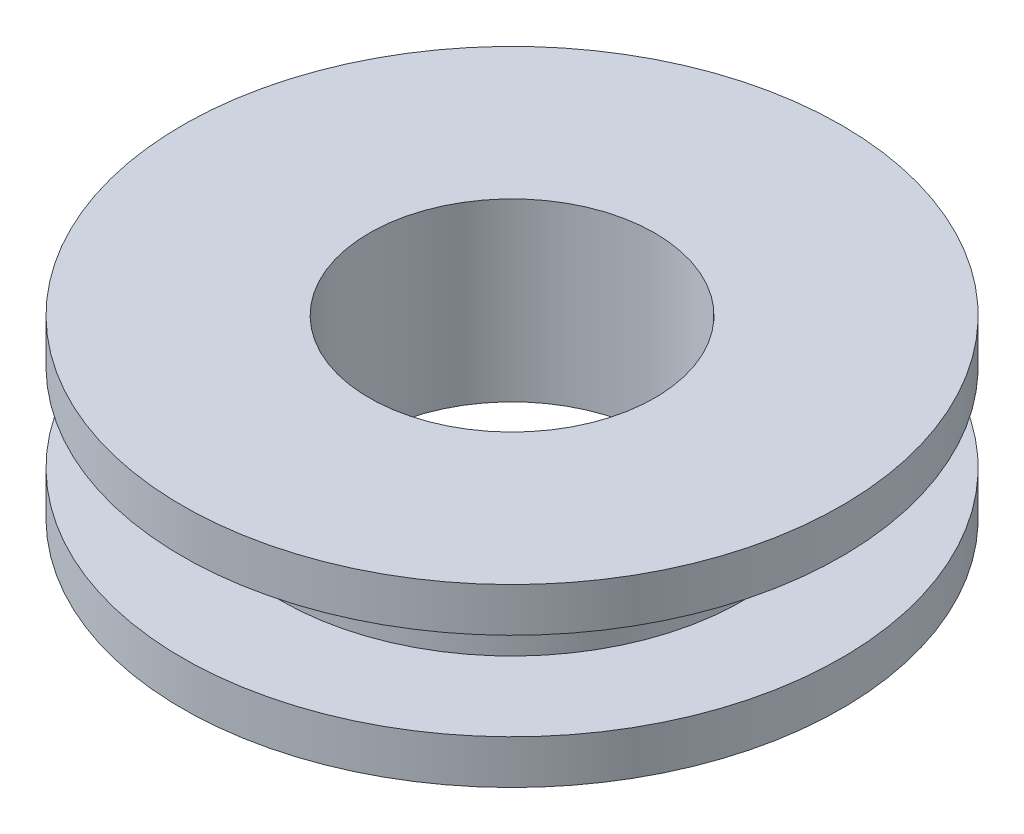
SolidWorks part; units mm, degrees
ref_plane "Front Plane" through (0, 0, 0) normal (0, 0, 1) x (1, 0, 0)
ref_plane "Top Plane" through (0, 0, 0) normal (0, 1, 0) x (1, 0, 0)
ref_plane "Right Plane" through (0, 0, 0) normal (1, 0, 0) x (0, 0, -1)
sketch "Sketch1" plane through (0, 0, 0) normal (1, 0, 0) x (0, 0, -1)
  line L0 (75, 10) -> (75, 20)
  line L1 (75, 20) -> (32.5, 20)
  line L2 (32.5, 20) -> (32.5, -20)
  line L3 (32.5, -20) -> (75, -20)
  line L4 (75, -20) -> (75, -10)
  line L5 (75, -10) -> (52.5, -10)
  line L6 (52.5, -10) -> (52.5, 10)
  line L7 (52.5, 10) -> (75, 10)
  line L8 (0, -66.3062) -> (0, 66.3062) construction
  point P8 (32.5, 0)
  point P12 (0, 0)
  dimension "D1" = 150
  dimension "D2" = 40
  dimension "D3" = 20
  dimension "D4" = 65
  dimension "D5" = 20
revolve "Revolve1" add sketch "Sketch1" angle 360 about L8
